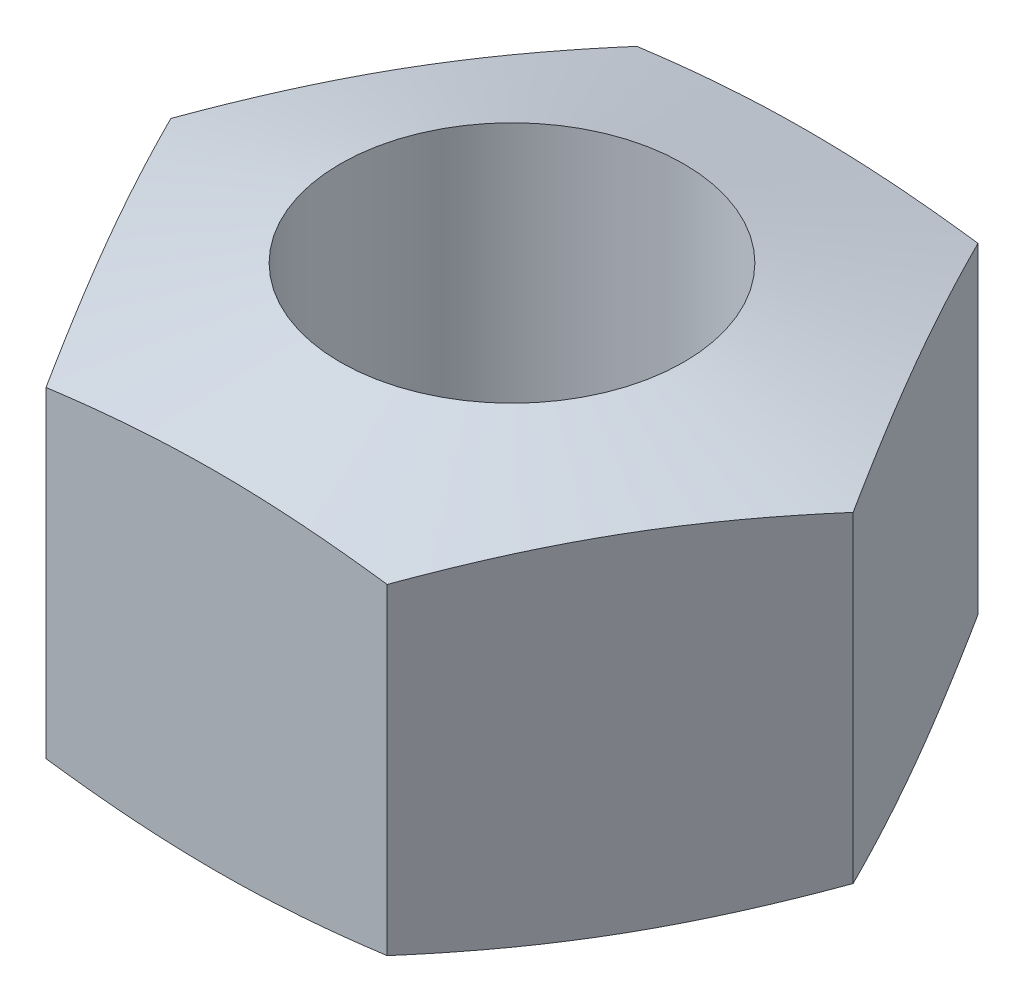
SolidWorks part; units mm, degrees
ref_plane "Front Plane" through (0, 0, 0) normal (0, 0, 1) x (1, 0, 0)
ref_plane "Top Plane" through (0, 0, 0) normal (0, 1, 0) x (1, 0, 0)
ref_plane "Right Plane" through (0, 0, 0) normal (1, 0, 0) x (0, 0, -1)
sketch "Sketch1" plane through (0, 0, 0) normal (0, 1, 0) x (1, 0, 0)
  line L1 (2.4826, 0) -> (1.2413, 2.15)
  line L2 (1.2413, 2.15) -> (-1.2413, 2.15)
  line L3 (-1.2413, 2.15) -> (-2.4826, 0)
  line L4 (-2.4826, 0) -> (-1.2413, -2.15)
  line L5 (-1.2413, -2.15) -> (1.2413, -2.15)
  line L6 (1.2413, -2.15) -> (2.4826, 0)
  circle A0 centre (0, 0) radius 2.15 construction
  dimension "D1" = 4.3
extrude "Boss-Extrude1" add sketch "Sketch1" along normal mid plane 3
sketch "Sketch2" plane through (0, 1.5, 0) normal (0, 1, 0) x (1, 0, 0)
  circle A0 centre (0, 0) radius 1.25
  dimension "D1" = 2.5
extrude "Cut-Extrude1" cut sketch "Sketch2" against normal blind 3 draft 75 flip side to cut
mirror "Mirror1" about plane through (0, 0, 0) normal (0, 1, 0) of "Cut-Extrude1"
sketch "Sketch3" plane through (0, 1.5, 0) normal (0, 1, 0) x (1, 0, 0)
  circle A1 centre (0, 0) radius 1.25
  circle A2 centre (0, 0) radius 1.25
  dimension "D1" = 0
extrude "Cut-Extrude2" cut sketch "Sketch3" against normal blind 3
